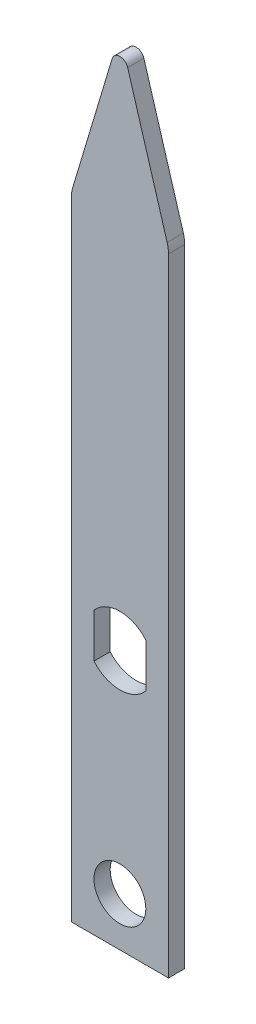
SolidWorks part; units mm, degrees
ref_plane "Plan de face" through (0, 0, 0) normal (0, 0, 1) x (1, 0, 0)
ref_plane "Plan de dessus" through (0, 0, 0) normal (0, 1, 0) x (1, 0, 0)
ref_plane "Plan de droite" through (0, 0, 0) normal (1, 0, 0) x (0, 0, -1)
sketch "Esquisse1" plane through (0, 0, 0) normal (0, 0, 1) x (1, 0, 0)
  line L0 (-15, 0) -> (-15, 195)
  line L1 (-15, 195) -> (0, 245)
  line L2 (0, 245) -> (15, 195)
  line L3 (15, 195) -> (15, 0)
  line L4 (15, 0) -> (-15, 0)
  point P2 (0, 0)
  dimension "D1" = 30
  dimension "D2" = 245
  dimension "D3" = 195
extrude "Extrusion1" add sketch "Esquisse1" along normal blind 5
sketch "Esquisse2" plane through (0, 0, 5) normal (0, 0, 1) x (1, 0, 0)
  line L0 (-15, 0) -> (15, 0) construction
  circle A0 centre (0, 15) radius 8
  dimension "D1" = 16
  dimension "D2" = 15
extrude "Extrusion2" cut sketch "Esquisse2" against normal up to next
sketch "Esquisse3" plane through (0, 0, 5) normal (0, 0, 1) x (1, 0, 0)
  line L0 (-8, 86.8007) -> (-8, 73.1993)
  line L1 (8, 86.8007) -> (8, 73.1993)
  arc A0 (8, 86.8007) -> (-8, 86.8007) centre (0, 80) ccw
  arc A1 (-8, 73.1993) -> (8, 73.1993) centre (0, 80) ccw
  circle A2 centre (0, 15) radius 8 construction
  dimension "D1" = 65
  dimension "D2" = 10.5
  dimension "D3" = 16
extrude "Extrusion3" cut sketch "Esquisse3" against normal up to next
fillet "Congé2" radius 2.5 1 edges at (0, 245, 2.5)
fillet "Congé3" radius 10 2 edges at (15, 195, 2.5) (-15, 195, 2.5)
